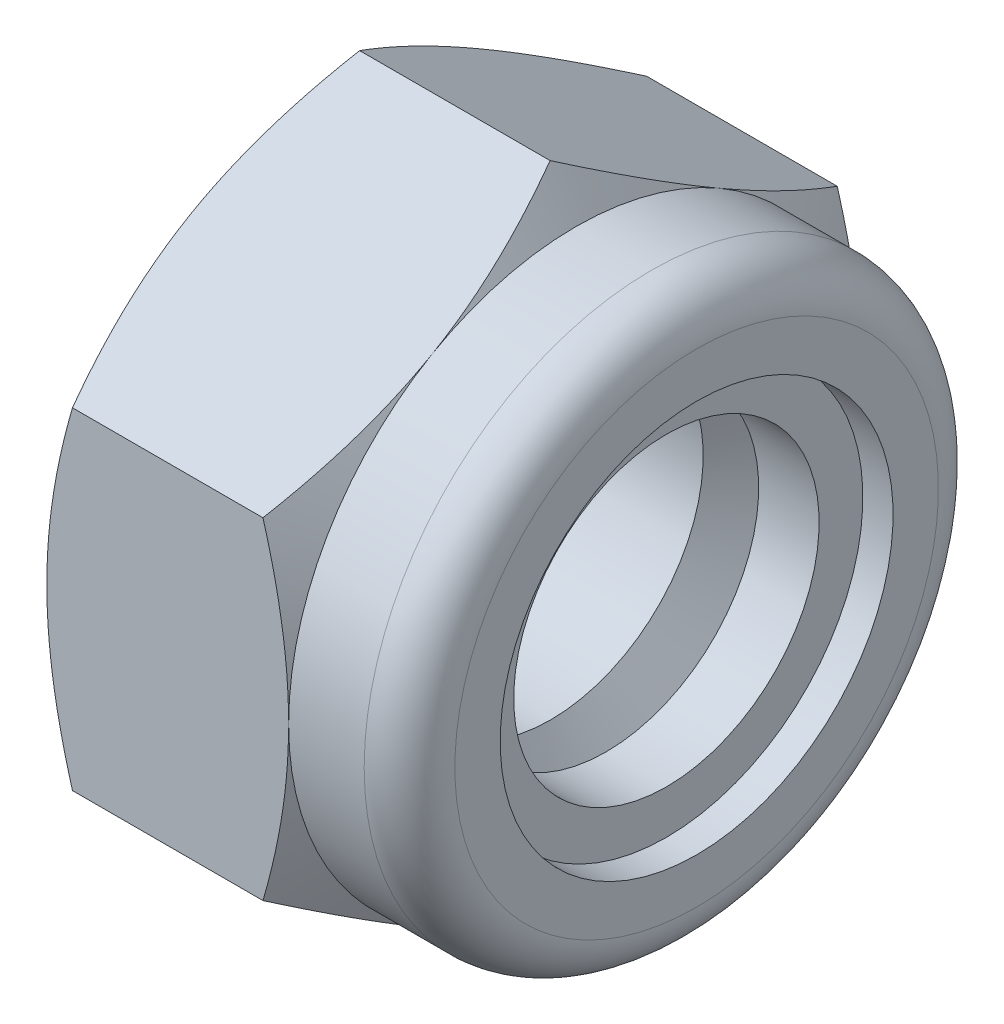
SolidWorks part; units mm, degrees
ref_plane "Ebene vorne" through (0, 0, 0) normal (0, 0, 1) x (1, 0, 0)
ref_plane "Ebene oben" through (0, 0, 0) normal (0, 1, 0) x (1, 0, 0)
ref_plane "Ebene rechts" through (0, 0, 0) normal (1, 0, 0) x (0, 0, -1)
ref_plane "Ebene1" through (0, 0, 0) normal (0, 0, 1) x (1, 0, 0)
sketch "Skizze1" plane through (0, 0, 0) normal (0, 0, 1) x (1, 0, 0)
  line L0 (0, 6.5) -> (0.8354, 5.053)
  line L1 (0.8354, 5.053) -> (7.1646, 5.053)
  line L2 (7.1646, 5.053) -> (8, 6.5)
  line L3 (8, 6.5) -> (9, 6.5)
  line L4 (9, 6.5) -> (9, 5.053)
  line L5 (9, 5.053) -> (11, 5.053)
  line L6 (11, 5.053) -> (11, 6.5)
  line L7 (11, 6.5) -> (12, 6.5)
  line L8 (12, 6.5) -> (12, 8)
  line L9 (10.5, 9.5) -> (8, 9.5)
  line L10 (8, 9.5) -> (5.2576, 14.25)
  line L11 (5.2576, 14.25) -> (2.7424, 14.25)
  line L12 (2.7424, 14.25) -> (0, 9.5)
  line L13 (0, 9.5) -> (0, 6.5)
  line L14 (12, 0) -> (0, 0) construction
  arc A0 (12, 8) -> (10.5, 9.5) centre (10.5, 8) ccw
revolve "Rotation1" add sketch "Skizze1" angle 360 about L14
ref_plane "Ebene2" through (0, 0, 0) normal (1, 0, 0) x (0, 0, -1)
sketch "Skizze2" plane through (0, 0, 0) normal (1, 0, 0) x (0, 0, -1)
  line L0 (-19, -19) -> (19, -19)
  line L1 (19, -19) -> (19, 19)
  line L2 (19, 19) -> (-19, 19)
  line L3 (-19, 19) -> (-19, -19)
  line L4 (-9.5, 5.4848) -> (-9.5, -5.4848)
  line L5 (-9.5, -5.4848) -> (0, -10.9697)
  line L6 (0, -10.9697) -> (9.5, -5.4848)
  line L7 (9.5, -5.4848) -> (9.5, 5.4848)
  line L8 (9.5, 5.4848) -> (0, 10.9697)
  line L9 (0, 10.9697) -> (-9.5, 5.4848)
extrude "Schnitt-Linear austragen1" cut sketch "Skizze2" against normal blind 13 and the other way blind 13
